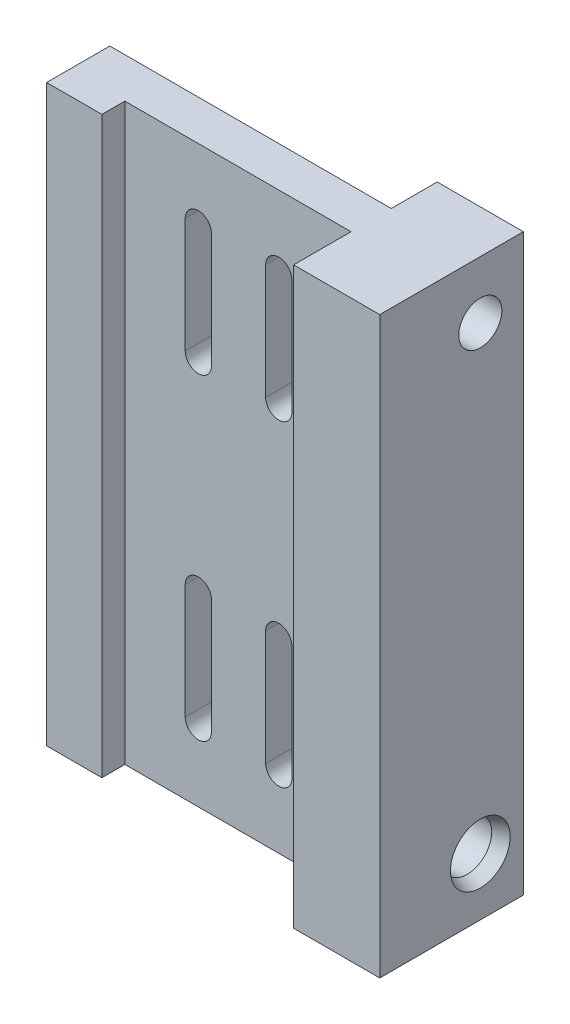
SolidWorks part; units mm, degrees
ref_plane "Front Plane" through (0, 0, 0) normal (0, 0, 1) x (1, 0, 0)
ref_plane "Top Plane" through (0, 0, 0) normal (0, 1, 0) x (1, 0, 0)
ref_plane "Right Plane" through (0, 0, 0) normal (1, 0, 0) x (0, 0, -1)
sketch "Sketch1" plane through (0, 0, 0) normal (0, 0, 1) x (1, 0, 0)
  line L0 (-7.8787, 14.224) -> (-7.8787, -49.276) construction
  line L1 (16.8787, 14.224) -> (16.8787, -49.276) construction
  line L2 (-14.2287, 14.224) -> (26.4037, 14.224)
  line L3 (-14.2287, -49.276) -> (26.4037, -49.276)
  line L4 (26.4037, 14.224) -> (26.4037, -49.276)
  line L5 (-14.2287, 14.224) -> (-14.2287, -49.276)
  line L6 (-1.45, 6.35) -> (-1.45, -6.35)
  line L7 (1.45, 6.35) -> (1.45, -6.35)
  line L8 (10.34, 6.35) -> (10.34, -6.35)
  line L9 (7.44, 6.35) -> (7.44, -6.35)
  line L10 (1.45, -28.702) -> (1.45, -41.402)
  line L11 (-1.45, -28.702) -> (-1.45, -41.402)
  line L12 (10.34, -28.702) -> (10.34, -41.402)
  line L13 (7.44, -28.702) -> (7.44, -41.402)
  line L14 (1.45, 6.35) -> (10.34, 6.35) construction
  line L15 (1.45, 6.35) -> (1.45, -28.702) construction
  arc A0 (10.34, 6.35) -> (7.44, 6.35) centre (8.89, 6.35) ccw
  arc A1 (7.44, -6.35) -> (10.34, -6.35) centre (8.89, -6.35) ccw
  arc A2 (1.45, -28.702) -> (-1.45, -28.702) centre (0, -28.702) ccw
  arc A3 (-1.45, -41.402) -> (1.45, -41.402) centre (0, -41.402) ccw
  arc A4 (-1.45, -6.35) -> (1.45, -6.35) centre (0, -6.35) ccw
  arc A5 (10.34, -28.702) -> (7.44, -28.702) centre (8.89, -28.702) ccw
  arc A6 (7.44, -41.402) -> (10.34, -41.402) centre (8.89, -41.402) ccw
  arc A8 (1.45, 6.35) -> (-1.45, 6.35) centre (0, 6.35) ccw
  point P2 (-1.45, 0)
  point P3 (1.45, 0)
  dimension "D1" = 2.9
  dimension "D3" = 14.2287
  dimension "D4" = 14.224
  dimension "D9" = 1.45
  dimension "D6" = 12.7
  dimension "D10" = 90
  dimension "D2" = 63.5
  dimension "D5" = 24.7574
  dimension "D7" = 9.525
  dimension "D8" = 6.35
extrude "Extrude1" add sketch "Sketch1" along normal blind 15.875
sketch "Sketch3" plane through (0, 14.224, 0) normal (0, 1, 0) x (-1, 0, 0)
  line L0 (-26.4037, 15.875) -> (14.2287, 15.875) construction
  line L1 (8.1213, 15.875) -> (-16.8787, 15.875)
  line L2 (8.1213, 15.875) -> (8.1213, 9.525)
  line L3 (8.1213, 9.525) -> (-16.8787, 9.525)
  line L4 (-16.8787, 15.875) -> (-16.8787, 9.525)
  line L5 (-26.4037, 15.875) -> (-26.4037, 0) construction
  line L6 (-26.4037, 0) -> (14.2287, 0) construction
  line L8 (-16.8787, 0) -> (14.2287, 0)
  line L9 (-16.8787, 0) -> (-16.8787, 5.08)
  line L10 (-16.8787, 5.08) -> (14.2287, 5.08)
  line L11 (14.2287, 0) -> (14.2287, 5.08)
  line L12 (14.2287, 15.875) -> (14.2287, 0) construction
  dimension "D1" = 9.525
  dimension "D2" = 25
  dimension "D3" = 6.35
  dimension "D4" = 5.08
extrude "Cut-Extrude1" cut sketch "Sketch3" against normal through all
sketch "Sketch4" plane through (26.4037, 0, 0) normal (1, 0, 0) x (0, 0, -1)
  line L0 (-15.875, 14.224) -> (0, 14.224) construction
  line L1 (0, -49.276) -> (0, 14.224) construction
  circle A0 centre (-4.7625, 7.874) radius 2.3812
  dimension "D1" = 4.7625
  dimension "D3" = 4.7625
  dimension "D2" = 6.35
extrude "Cut-Extrude2" cut sketch "Sketch4" against normal up to surface (9.525 mm away)
sketch "Sketch5" plane through (26.4037, 0, 0) normal (1, 0, 0) x (0, 0, -1)
  line L0 (0, -49.276) -> (0, 14.224) construction
  line L1 (-15.875, -49.276) -> (0, -49.276) construction
  point P0 (-4.7625, -42.926)
  dimension "D1" = 4.7625
  dimension "D2" = 6.35
hole_wizard "1/4-28 Tapped Hole1" positions "3DSketch1" profile "Sketch6" tap size "1/4-28" standard "Ansi Inch"
sketch3d "3DSketch1"
  point P0 (26.4037, -42.926, 4.7625)
sketch "Sketch6" plane through (26.4037, -42.926, 4.7625) normal (0, 1, 0) x (0, 0, -1)
  line L0 (0, 0) -> (0, 13.8174)
  line L1 (0, 13.8174) -> (2.7051, 12.192)
  line L2 (2.7051, 12.192) -> (2.7051, 1.441)
  line L3 (2.7051, 1.441) -> (3.302, 0)
  line L5 (3.302, 0) -> (0, 0)
  line L6 (-2.7051, 1.441) -> (-3.302, 0) construction
  line L10 (0, 13.8174) -> (-2.7051, 12.192) construction
  line L11 (0, -6.35) -> (0, 107.95) construction
  dimension "Tap Drill Dia." = 5.4102
  dimension "Tap Drill Depth" = 12.192
  dimension "Near C'Sink Dia." = 6.604
  dimension "Near C'Sink Angle" = 45
  dimension "Drill Angle" = 118
sketch "Sketch7" plane through (0, 0, 15.875) normal (0, 0, 1) x (1, 0, 0)
  line L1 (-14.2287, 14.224) -> (-8.1213, 14.224)
  line L2 (-14.2287, 14.224) -> (-14.2287, -49.276)
  line L3 (-14.2287, -49.276) -> (-8.1213, -49.276)
  line L4 (-8.1213, 14.224) -> (-8.1213, -49.276)
extrude "Cut-Extrude3" cut sketch "Sketch7" against normal blind 3.81
